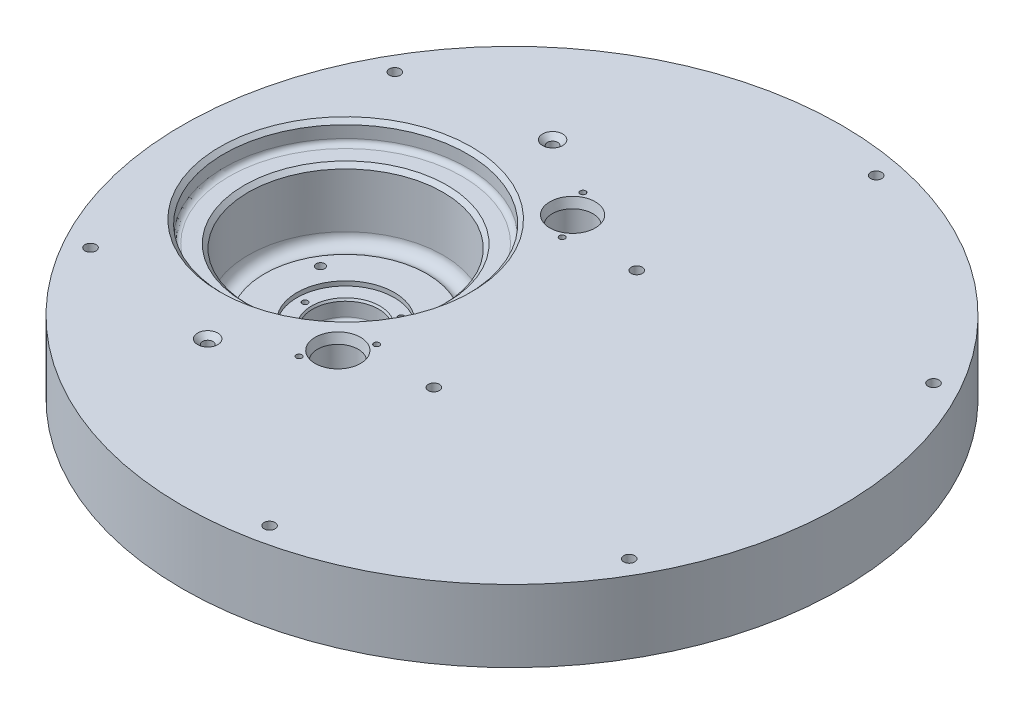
SolidWorks part; units mm, degrees
ref_plane "Front Plane" through (0, 0, 0) normal (0, 0, 1) x (1, 0, 0)
ref_plane "Top Plane" through (0, 0, 0) normal (0, 1, 0) x (1, 0, 0)
ref_plane "Right Plane" through (0, 0, 0) normal (1, 0, 0) x (0, 0, -1)
sketch "Sketch3" plane through (0, 0, 0) normal (0, 0, 1) x (1, 0, 0)
  line L0 (0, 0) -> (0, 118.5233) construction
  line L1 (177.8, 0) -> (38.1, 0)
  line L2 (30.48, -6.604) -> (30.48, -24.892)
  line L3 (25.4, -27.432) -> (15.24, -27.432)
  line L4 (8.636, -30.48) -> (8.636, -7.874) construction
  line L5 (8.636, -7.874) -> (0, -7.874) construction
  line L6 (0, -7.874) -> (0, -9.906) construction
  line L7 (0, -9.906) -> (7.366, -9.906) construction
  line L8 (7.366, -9.906) -> (7.366, -37.592) construction
  line L9 (7.366, -37.592) -> (36.195, -37.592)
  line L10 (36.195, -37.592) -> (36.195, -22.5425)
  line L11 (36.195, -22.5425) -> (177.8, -22.5425)
  line L12 (177.8, -22.5425) -> (177.8, 0)
  line L13 (30.48, -6.604) -> (38.1, -6.604)
  line L14 (38.1, -6.604) -> (38.1, 0)
  line L15 (10.3378, -28.829) -> (15.24, -28.829)
  line L16 (7.366, -34.544) -> (7.366, -37.592)
  line L17 (7.366, -34.544) -> (10.3378, -34.544)
  line L18 (10.3378, -34.544) -> (10.3378, -28.829)
  line L19 (15.24, -28.829) -> (15.24, -27.432)
  line L20 (10.3378, -28.829) -> (10.3378, -27.432) construction
  line L21 (10.3378, -27.432) -> (15.24, -27.432) construction
  line L22 (29.21, -27.432) -> (30.48, -21.0216) construction
  arc A0 (25.4, -27.432) -> (30.48, -24.892) centre (27.305, -24.892) ccw
  dimension "D11" = 7.112
  dimension "D3" = 3.175
  dimension "D1" = 60.96
  dimension "D2" = 27.432
  dimension ".78" = 22.5425
  dimension "D4" = 355.6
  dimension "D5" = 76.2
  dimension "D6" = 20.828
  dimension "D7" = 8.636
  dimension "D8" = 7.366
  dimension "D9" = 19.558
  dimension "D10" = 2.032
  dimension "D12" = 20.6756
  dimension "D13" = 30.48
  dimension "D14" = 1.397
  dimension "D15" = 72.39
  dimension "D16" = 10.16
  dimension "D17" = 37.592
  dimension "D18" = 1.27
revolve "Revolve1" add sketch "Sketch3" angle 360 about L0
chamfer "Chamfer4" distance 0.381 angle 60 1 edges at (0, -28.829, -10.3378)
sketch "Sketch4" plane through (0, 0, 0) normal (0, 1, 0) x (1, 0, 0)
  line L0 (0, 0) -> (52.07, 0) construction
  line L1 (52.07, -103.1621) -> (52.07, 103.1621) construction
  line L2 (-51.0921, 0) -> (52.07, 0) construction
  line L3 (0.4889, 89.341) -> (0.4889, -89.341) construction
  circle A0 centre (52.07, 0) radius 103.1621
  circle A1 centre (-51.0921, 0) radius 103.1621 construction
  dimension "D1" = 206.3242
  dimension "D2" = 52.07
extrude "Cut-Extrude1" cut sketch "Sketch4" against normal through all flip side to cut
sketch "Sketch30" plane through (0, -6.604, 0) normal (0, 1, 0) x (1, 0, 0)
  line L0 (0, 44.0093) -> (0, 21.5836) construction
  line L1 (0, 21.5836) -> (0, 0) construction
  circle A0 centre (0, 0) radius 44.0093
  arc A1 (15.9166, 25.9941) -> (-15.9166, 25.9941) centre (0, 21.5836) ccw
  arc A3 (30.4698, 0.7871) -> (15.9166, 25.9941) centre (0, 0) ccw
  circle A4 centre (0, 0) radius 30.48 construction
  circle A5 centre (0, 0) radius 21.5836 construction
  arc A6 (14.5532, -26.7812) -> (30.4698, 0.7871) centre (18.692, -10.7918) ccw
  arc A7 (-30.4698, 0.7871) -> (-14.5532, -26.7812) centre (-18.692, -10.7918) ccw
  arc A8 (-14.5532, -26.7812) -> (14.5532, -26.7812) centre (0, 0) ccw
  arc A9 (-15.9166, 25.9941) -> (-30.4698, 0.7871) centre (0, 0) ccw
  circle A10 centre (0, 0) radius 38.1 construction
  point P19 (0, 0)
  dimension "D1" = 43.1673
  dimension "D2" = 3
sketch "Sketch23" plane through (0, -37.592, 0) normal (0, -1, 0) x (1, 0, 0)
  line L0 (0, 0) -> (-36.195, 0) construction
  line L1 (3.4925, 0) -> (0, 0) construction
  circle A0 centre (3.4925, 0) radius 39.6875
  circle A1 centre (0, 0) radius 36.195 construction
  circle A2 centre (0, 0) radius 31.75
  dimension "D1" = 79.375
  dimension "D2" = 63.5
extrude "Boss-Extrude2" add sketch "Sketch23" against normal up to surface (15.0495 mm away)
hole_wizard "#30 (0.1285) Diameter Hole1" positions "Sketch7" profile "Sketch6" hole size "#30" standard "ANSI Inch"
sketch "Sketch7" plane through (0, -22.5425, 0) normal (0, 1, 0) x (1, 0, 0)
  line L0 (10.795, 53.975) -> (0, 0) construction
  line L1 (0, 0) -> (10.795, -53.975) construction
  line L3 (10.795, 53.975) -> (10.795, -53.975) construction
  line L5 (0, 0) -> (10.795, 0) construction
  line L6 (10.795, 0) -> (52.07, 0) construction
  point P0 (10.795, -53.975)
  point P2 (10.795, 53.975)
  dimension "D1" = 107.95
  dimension "D2" = 41.275
sketch "Sketch6" plane through (10.795, -22.5425, 53.975) normal (1, 0, 0) x (0, 0, -1)
  line L0 (0, 0) -> (0, 22.5425)
  line L1 (0, 22.5425) -> (1.6319, 22.5425)
  line L2 (1.6319, 22.5425) -> (1.6319, 0)
  line L5 (1.6319, 0) -> (0, 0)
  line L11 (0, -6.35) -> (0, 107.95) construction
  dimension "Thru Hole Dia." = 3.2639
  dimension "Thru Hole Depth" = 22.5425
ref_plane "Plane1" through (0, 0, 53.975) normal (0, 0, 1) x (1, 0, 0)
sketch "Sketch219" plane through (0, 0, 53.975) normal (0, 0, 1) x (1, 0, 0)
  line L0 (10.795, -22.5425) -> (10.795, 27.4283)
  line L1 (14.2494, -10.6553) -> (12.3825, -9.5336)
  line L2 (14.9421, -20.6629) -> (14.2494, -19.9702)
  line L3 (14.9421, -20.6629) -> (15.3416, -22.5425)
  line L4 (15.3416, -22.5425) -> (10.795, -22.5425)
  line L5 (10.795, -22.5425) -> (10.795, 42.3633) construction
  line L6 (14.2494, -19.9702) -> (14.2494, -10.6553)
  line L10 (19.3294, -23.7831) -> (19.3294, -22.5425) construction
  line L11 (19.3294, -22.5425) -> (15.3416, -22.5425) construction
  line L12 (12.3825, -9.5336) -> (12.3825, 26.4744)
  line L13 (12.3825, 26.4744) -> (10.795, 27.4283)
  line L14 (10.795, 0) -> (10.795, -22.5425) construction
  line L15 (9.1631, -22.5425) -> (12.4269, -22.5425) construction
  dimension "D1" = 12
  dimension "D2" = 45
  dimension "D3" = 1.8796
  dimension "D5" = 8.5344
  dimension "D6" = 9.0932
  dimension "D7" = 59
  dimension "D8" = 11.8872
  dimension "D9" = 3.175
  dimension ".375" = 6.9088
revolve "Cut-Revolve2" cut sketch "Sketch219" angle 360 about L5
chamfer "Chamfer1" distance 1.524 angle 45 2 edges at (10.795, 0, 52.3431) (10.795, 0, -55.6069)
sketch "Sketch11" plane through (0, -22.5425, 0) normal (0, -1, 0) x (1, 0, 0)
  line L0 (52.07, 88.265) -> (52.07, -88.265) construction
  line L1 (52.07, 0) -> (140.335, 0) construction
  line L2 (77.47, -12.7) -> (139.4166, -12.7)
  line L3 (42.545, 87.7496) -> (42.545, 36.7423)
  line L4 (77.47, 12.7) -> (139.4166, 12.7)
  line L5 (67.945, 86.8257) -> (67.945, 22.225)
  line L6 (67.945, -22.225) -> (67.945, -86.8257)
  line L7 (67.945, 12.7) -> (67.945, -12.7) construction
  line L8 (42.545, -36.7423) -> (34.29, -36.7423) construction
  line L9 (34.29, -36.7423) -> (34.29, 36.7423) construction
  line L10 (42.545, -36.7423) -> (42.545, -87.7496)
  line L11 (42.545, 36.7423) -> (42.545, -36.7423) construction
  line L12 (34.29, 36.7423) -> (42.545, 36.7423) construction
  circle A0 centre (3.4925, 0) radius 39.6875 construction
  arc A1 (42.545, -87.7496) -> (67.945, -86.8257) centre (52.07, 0) ccw
  arc A2 (67.945, 86.8257) -> (42.545, 87.7496) centre (52.07, 0) ccw
  arc A3 (77.47, -12.7) -> (67.945, -22.225) centre (77.47, -22.225) ccw
  arc A4 (139.4166, -12.7) -> (139.4166, 12.7) centre (52.07, 0) ccw
  arc A5 (28.9871, -30.4158) -> (28.9871, 30.4158) centre (3.4925, 0) ccw
  arc A6 (28.9871, 30.4158) -> (42.545, 36.7423) centre (34.29, 36.7423) ccw
  arc A7 (42.545, -36.7423) -> (28.9871, -30.4158) centre (34.29, -36.7423) ccw
  arc A8 (77.47, 12.7) -> (67.945, 22.225) centre (77.47, 22.225) cw
  circle A9 centre (52.07, 0) radius 103.1621 construction
  circle A10 centre (52.07, 0) radius 88.265 construction
  dimension "D3" = 8.255
  dimension "D4" = 9.525
  dimension "D1" = 25.4
  dimension "D2" = 25.4
  dimension "D5" = 9.525
extrude "Boss-Extrude1" add sketch "Sketch11" along normal up to surface (15.0495 mm away)
sketch "Sketch29" plane through (0, -22.5425, 0) normal (0, -1, 0) x (1, 0, 0)
  line L0 (42.545, 51.8628) -> (42.545, 36.7423)
  line L1 (0, 0) -> (86.9994, 0) construction
  line L2 (42.545, -51.8628) -> (42.545, -36.7423)
  arc A0 (28.9871, 30.4158) -> (42.545, 36.7423) centre (34.29, 36.7423) ccw
  arc A1 (35.4012, 45.5626) -> (42.545, 51.8628) centre (36.195, 51.8628) ccw
  arc A2 (18.005, 36.9389) -> (26.1449, 40.3046) centre (20.327, 42.8491) ccw
  arc A3 (28.9871, 30.4158) -> (18.005, 36.9389) centre (3.4925, 0) ccw
  arc A4 (28.9871, 30.4158) -> (28.9871, -30.4158) centre (3.4925, 0) ccw construction
  arc A5 (28.9871, 30.4158) -> (42.545, 36.7423) centre (34.29, 36.7423) ccw construction
  arc A6 (35.4012, 45.5626) -> (26.1449, 40.3046) centre (34.29, 36.7423) ccw
  arc A7 (35.4012, -45.5626) -> (42.545, -51.8628) centre (36.195, -51.8628) cw
  arc A8 (28.9871, -30.4158) -> (42.545, -36.7423) centre (34.29, -36.7423) cw
  arc A9 (28.9871, -30.4158) -> (18.005, -36.9389) centre (3.4925, 0) cw
  arc A10 (18.005, -36.9389) -> (26.1449, -40.3046) centre (20.327, -42.8491) cw
  arc A11 (35.4012, -45.5626) -> (26.1449, -40.3046) centre (34.29, -36.7423) cw
  dimension "D1" = 8.89
  dimension "D2" = 6.35
chamfer "Chamfer5" distance 14.986 angle 30 3 edges at (55.2784, -37.592, 88.2067) (140.335, -37.592, 0) (55.2784, -37.592, -88.2067)
fillet "Fillet7" radius 4.7752 11 edges at (67.945, -22.5425, 54.5253) (108.4433, -22.5425, -12.7) (42.545, -22.5425, 62.2459) (37.7807, -22.5425, 29.2617) (42.545, -22.5425, -62.2459) (37.7807, -22.5425, -29.2617) (108.4433, -22.5425, 12.7) (67.945, -22.5425, -54.5253) (-36.195, -22.5425, 0) (70.7348, -22.5425, 15.4898) (70.7348, -22.5425, -15.4898)
hole_wizard "Pene-Ports" positions "Sketch13" profile "Sketch12" counterbore size "#10" standard "ANSI Inch"
sketch "Sketch13" plane through (0, 0, 0) normal (0, 1, 0) x (1, 0, 0)
  line L0 (34.29, 36.7423) -> (34.29, -36.7423) construction
  line L1 (34.29, 0) -> (0, 0) construction
  arc A0 (28.9871, 30.4158) -> (42.545, 36.7423) centre (34.29, 36.7423) ccw construction
  point P0 (34.29, 36.7423)
  point P2 (34.29, -36.7423)
sketch "Sketch12" plane through (34.29, 0, -36.7423) normal (1, 0, 0) x (0, 0, 1)
  line L0 (0, 0) -> (0, 53.7142)
  line L1 (0, 53.7142) -> (4.85, 50.8)
  line L2 (4.85, 50.8) -> (4.85, 17.272)
  line L3 (4.85, 17.272) -> (6.35, 17.272)
  line L5 (6.35, 17.272) -> (6.35, 2.8438)
  line L6 (6.35, 2.8438) -> (7.112, 0)
  line L7 (7.112, 0) -> (0, 0)
  line L10 (0, 53.7142) -> (-4.85, 50.8) construction
  line L11 (0, -6.35) -> (0, 107.95) construction
  dimension "Hole Dia." = 9.7
  dimension "Hole Depth" = 50.8
  dimension "C'Bore Dia." = 12.7
  dimension "Drill Angle" = 118
fillet "Fillet5" radius 0.762 3 edges at (0, -34.544, -10.3378) (34.29, -17.272, -30.3923) (34.29, -17.272, 43.0923)
fillet "Fillet8" radius 1.5875 1 edges at (0, -6.604, -38.1)
chamfer "Chamfer8" distance 1.27 angle 45 2 edges at (0, -6.604, -30.48) (0, 0, -38.1)
chamfer "Chamfer6" distance 0.254 angle 30 2 edges at (0, -37.592, -7.366) (0, -34.544, -7.366)
sketch "Sketch14" plane through (0, 0, 0) normal (0, 0, 1) x (1, 0, 0)
  line L0 (52.07, 0) -> (52.07, 60.9046) construction
  line L1 (-48.7045, -13.9446) -> (-38.5763, -13.9446)
  line L2 (52.07, 0) -> (155.2321, 0) construction
  line L3 (52.07, 0) -> (-51.0921, 0) construction
  line L4 (-36.195, -16.3259) -> (-36.195, -23.0201)
  line L5 (-58.5313, -32.8598) -> (-36.195, -37.592)
  line L6 (-36.195, -37.592) -> (28.9871, -37.592) construction
  line L7 (-51.0921, 0) -> (-58.5313, 0)
  line L8 (-58.5313, 0) -> (-58.5313, -15.24)
  line L9 (-51.0921, -11.9126) -> (-48.3462, -11.9126) construction
  line L10 (-48.514, -2.7686) -> (-51.0921, -6.8326) construction
  line L11 (-51.0921, -9.8806) -> (-51.0921, -13.9446)
  line L12 (-51.0921, -12.6746) -> (-49.3248, -14.4419) construction
  line L13 (-48.7045, -13.9446) -> (-48.1456, -10.7749) construction
  line L14 (-48.896, -9.8806) -> (-51.0921, -9.8806) construction
  line L15 (-51.0921, 0) -> (-51.0921, -22.5425) construction
  line L16 (-51.0921, -9.8806) -> (-51.0921, -6.8326)
  line L17 (-51.0921, -6.8326) -> (-48.514, -6.8326) construction
  line L18 (-48.514, -6.8326) -> (-48.514, -2.7686) construction
  line L19 (-48.514, -2.7686) -> (-51.0921, -2.7686) construction
  line L20 (-51.0921, -2.7686) -> (-51.0921, 0)
  line L21 (-51.0921, 0) -> (-51.0921, -22.5425) construction
  line L22 (-58.5313, -15.24) -> (-58.5313, -32.8598)
  line L23 (-51.0921, -13.9446) -> (-48.7045, -13.9446)
  line L25 (-36.195, -23.0201) -> (-36.195, -37.592)
  line L26 (-51.0921, -6.8326) -> (-51.0921, -2.7686)
  arc A0 (-48.1456, -10.7749) -> (-48.896, -9.8806) centre (-48.896, -10.6426) ccw construction
  arc A1 (-38.5763, -13.9446) -> (-36.195, -16.3259) centre (-38.5763, -16.3259) cw
  circle A2 centre (-49.8031, -4.8006) radius 1.7653 construction
  circle A3 centre (-49.7192, -11.9126) radius 1.7653 construction
  dimension "D6" = 0.762
  dimension "D9" = 2.3813
  dimension "D10" = 3.5306
  dimension "D1" = 100.584
  dimension "D2" = 4.064
  dimension "D3" = 4.064
  dimension "D4" = 201.549
  dimension "D5" = 10
  dimension "D7" = 45
  dimension "D8" = 13.9446
  dimension "D11" = 1.27
  dimension "D12" = 7.112
  dimension "D13" = 200.8324
revolve "Cut-Revolve1" [suppressed] cut sketch "Sketch14" angle 360 about L0
hole_wizard "#2-56 Tapped Hole1" positions "Sketch16" profile "Sketch15" tap size "#2-56" standard "ANSI Inch"
sketch "Sketch16" plane through (0, -28.829, 0) normal (0, 1, 0) x (1, 0, 0)
  line L3 (0, 0) -> (-12.7, 0) construction
  point P4 (-12.7, 0)
  dimension "D1" = 12.7
sketch "Sketch15" plane through (-12.7, -28.829, 0) normal (1, 0, 0) x (0, 0, 1)
  line L0 (0, 0) -> (0, 3.0742)
  line L1 (0, 3.0742) -> (0.889, 2.54)
  line L2 (0.889, 2.54) -> (0.889, 0)
  line L5 (0.889, 0) -> (0, 0)
  line L10 (0, 3.0742) -> (-0.889, 2.54) construction
  line L11 (0, -6.35) -> (0, 107.95) construction
  dimension "Tap Drill Dia." = 1.778
  dimension "Tap Drill Depth" = 2.54
  dimension "Drill Angle" = 118
sketch "Sketch17" plane through (0, -22.5425, 0) normal (0, -1, 0) x (1, 0, 0)
  circle A0 centre (10.795, 53.975) radius 3.048
  circle A1 centre (10.795, 53.975) radius 4.5466 construction
  dimension "D1" = 6.096
extrude "Cut-Extrude5" cut sketch "Sketch17" against normal blind 15.875
chamfer "Chamfer9" distance 0.508 angle 30 1 edges at (10.795, -10.4111, 50.927)
pattern_circular "CirPattern1" count 3 over 360 about axis through (0, 0, 0) along (0, 1, 0) of "#2-56 Tapped Hole1"
hole_wizard "#10-32 Tapped Hole1" positions "Sketch19" profile "Sketch20" tap size "#10-32" standard "ANSI Inch"
sketch "Sketch19" [suppressed] plane through (0, -13.9446, 0) normal (0, -1, 0) x (-1, 0, 0)
  line L0 (-16.2269, 86.5329) -> (-52.07, 0) construction
  line L1 (-52.07, 0) -> (-52.07, 118.0269) construction
  circle A0 centre (-52.07, 0) radius 100.7745 construction
  circle A1 centre (-52.07, 0) radius 93.6625 construction
  point P0 (-16.2269, 86.5329)
  dimension "D1" = 187.325
  dimension "D2" = 22.5
sketch "Sketch20" plane through (16.2269, -13.9446, -86.5329) normal (1, 0, 0) x (0, 0, -1)
  line L0 (0, 0) -> (0, 8.8333)
  line L1 (0, 8.8333) -> (2.0193, 7.62)
  line L2 (2.0193, 7.62) -> (2.0193, 6.35)
  line L3 (2.0193, 6.35) -> (2.413, 6.35)
  line L4 (2.413, 6.35) -> (2.413, 0)
  line L5 (2.413, 0) -> (0, 0)
  line L10 (0, 8.8333) -> (-2.0193, 7.62) construction
  line L11 (0, -6.35) -> (0, 107.95) construction
  dimension "Tap Drill Dia." = 4.0386
  dimension "Tap Drill Depth" = 7.62
  dimension "Thread Major Dia." = 4.826
  dimension "Thread Depth" = 6.35
  dimension "Drill Angle" = 118
pattern_circular "CirPattern2" [suppressed] count 8 over 360
hole_wizard "#8-32 Tapped Hole2" positions "Sketch22" profile "Sketch21" tap size "#8-32" standard "ANSI Inch"
sketch "Sketch22" plane through (0, 0, 0) normal (0, 1, 0) x (1, 0, 0)
  line L0 (52.07, 0) -> (52.07, 118.3341) construction
  circle A13 centre (71.12, -94.9452) radius 2.5337 construction
  circle A14 centre (-32.247, -47.625) radius 2.5336 construction
  circle A15 centre (-32.247, 47.625) radius 2.5336 construction
  circle A16 centre (71.12, 94.9452) radius 2.5337 construction
  circle A17 centre (59.3684, 31.75) radius 2.5336 construction
  circle A18 centre (59.3684, -31.75) radius 2.5336 construction
  point P0 (71.12, 94.9452)
  point P2 (-32.247, 47.625)
  point P4 (-32.247, -47.625)
  point P6 (71.12, -94.9452)
  point P8 (59.3684, 31.75)
  point P10 (59.3684, -31.75)
  point P53 (136.387, -47.625)
  point P54 (136.387, 47.625)
sketch "Sketch21" plane through (71.12, 0, -94.9452) normal (1, 0, 0) x (0, 0, 1)
  line L0 (0, 0) -> (0, 9.9278)
  line L1 (0, 9.9278) -> (1.7272, 8.89)
  line L2 (1.7272, 8.89) -> (1.7272, 0)
  line L5 (1.7272, 0) -> (0, 0)
  line L10 (0, 9.9278) -> (-1.7272, 8.89) construction
  line L11 (0, -6.35) -> (0, 107.95) construction
  dimension "Tap Drill Dia." = 3.4544
  dimension "Tap Drill Depth" = 8.89
  dimension "Drill Angle" = 118
hole_wizard "#6-32 Tapped Hole1" positions "Sketch25" profile "Sketch26" tap size "#6-32" standard "ANSI Inch"
sketch "Sketch25" plane through (0, -27.432, 0) normal (0, 1, 0) x (1, 0, 0)
  circle A3 centre (-18.6975, 10.795) radius 1.8288 construction
  circle A4 centre (0, -21.59) radius 1.8288 construction
  circle A5 centre (18.6975, 10.795) radius 1.8288 construction
  point P0 (-18.6975, 10.795)
  point P2 (18.6975, 10.795)
  point P4 (0, -21.59)
sketch "Sketch26" plane through (-18.6975, -27.432, -10.795) normal (1, 0, 0) x (0, 0, 1)
  line L0 (0, 0) -> (0, 5.5752)
  line L1 (0, 5.5752) -> (1.3525, 4.7625)
  line L2 (1.3525, 4.7625) -> (1.3525, 0)
  line L5 (1.3525, 0) -> (0, 0)
  line L10 (0, 5.5752) -> (-1.3526, 4.7625) construction
  line L11 (0, -6.35) -> (0, 107.95) construction
  dimension "Tap Drill Dia." = 2.7051
  dimension "Tap Drill Depth" = 4.7625
  dimension "Drill Angle" = 118
hole_wizard "#2-56 Tapped Hole2" positions "Sketch28" profile "Sketch27" tap size "#2-56" standard "ANSI Inch"
sketch "Sketch28" plane through (0, 0, 0) normal (0, 1, 0) x (1, 0, 0)
  circle A1 centre (38.735, -29.0433) radius 2.032 construction
  circle A2 centre (29.845, -44.4413) radius 2.032 construction
  circle A3 centre (29.845, 44.4413) radius 2.032 construction
  circle A4 centre (38.735, 29.0433) radius 2.032 construction
  point P0 (29.845, 44.4413)
  point P4 (38.735, 29.0433)
  point P8 (38.735, -29.0433)
  point P10 (29.845, -44.4413)
sketch "Sketch27" plane through (29.845, 0, -44.4413) normal (1, 0, 0) x (0, 0, 1)
  line L0 (0, 0) -> (0, 7.1763)
  line L1 (0, 7.1763) -> (0.889, 6.6421)
  line L2 (0.889, 6.6421) -> (0.889, 0)
  line L5 (0.889, 0) -> (0, 0)
  line L10 (0, 7.1763) -> (-0.889, 6.6421) construction
  line L11 (0, -6.35) -> (0, 107.95) construction
  dimension "Tap Drill Dia." = 1.778
  dimension "Tap Drill Depth" = 6.6421
  dimension "Drill Angle" = 118
chamfer "Chamfer7" distance 1.27 angle 45 11 edges at (42.545, -37.592, 57.8916) (42.545, -37.592, -57.8916) (37.7807, -37.592, 29.2617) (37.7807, -37.592, -29.2617) (-36.195, -37.592, 0) (67.945, -37.592, 50.1195) (70.7348, -37.592, 15.4898) (104.0667, -37.592, 12.7) (104.0667, -37.592, -12.7) (70.7348, -37.592, -15.4898) (67.945, -37.592, -50.1195)
sketch "Sketch9" plane through (0, 0, 0) normal (0, 1, 0) x (1, 0, 0)
  line L0 (0, 0) -> (-113.3456, 0) construction
  line L1 (-64.7098, 0) -> (173.9981, 0)
  arc A0 (-64.7098, 0) -> (173.9981, 0) centre (54.6442, 0) ccw
extrude "FEA-Cut-Extrude3" [suppressed] cut sketch "Sketch9" against normal through all
hole_wizard "M4x0.7 Tapped Hole1" positions "Sketch213" profile "Sketch212" tap size "M4x0.7" standard "ANSI Metric"
sketch "Sketch213" plane through (0, -22.5425, 0) normal (0, -1, 0) x (-1, 0, 0)
  line L0 (12.7, -48.26) -> (-52.07, 0) construction
  line L1 (-52.07, 0) -> (-52.07, -48.26) construction
  line L3 (12.7, -48.26) -> (-52.07, -48.26) construction
  point P0 (12.7, -48.26)
  dimension "D1" = 64.77
  dimension "D2" = 48.26
sketch "Sketch212" plane through (-12.7, -22.5425, 48.26) normal (1, 0, 0) x (0, 0, -1)
  line L0 (0, 0) -> (0, 22.5425)
  line L1 (0, 22.5425) -> (1.65, 22.5425)
  line L3 (1.65, 22.5425) -> (1.65, 6)
  line L4 (1.65, 6) -> (2, 6)
  line L5 (2, 6) -> (2, 0)
  line L7 (2, 0) -> (0, 0)
  line L11 (0, -6.35) -> (0, 107.95) construction
  dimension "Thru Tap Drill Dia." = 3.3
  dimension "Thru Tap Drill Depth" = 22.5425
  dimension "Thread Major Dia." = 4
  dimension "Thread Depth" = 6
sketch "Sketch214" [suppressed] plane through (0, -22.5425, 0) normal (0, -1, 0) x (1, 0, 0)
  line L1 (-9.35, 51.4397) -> (-13.7787, 52.7511) construction
  line L2 (-13.7787, 52.7511) -> (-17.1287, 49.5714) construction
  line L3 (-17.1287, 49.5714) -> (-16.05, 45.0803) construction
  line L4 (-16.05, 45.0803) -> (-11.6213, 43.7689) construction
  line L5 (-11.6213, 43.7689) -> (-8.2713, 46.9486) construction
  line L6 (-8.2713, 46.9486) -> (-9.35, 51.4397) construction
  circle A0 centre (-12.7, 48.26) radius 4.7625
  circle A1 centre (-12.7, 48.26) radius 4 construction
  dimension "D1" = 8
  dimension "D2" = 9.525
extrude "Cut-Extrude6" [suppressed] cut sketch "Sketch214" against normal blind 0.127
hole_wizard "#4-40 Tapped Hole1" positions "Sketch216" profile "Sketch215" tap size "#4-40" standard "ANSI Inch"
sketch "Sketch216" plane through (0, -37.592, 0) normal (0, -1, 0) x (-1, 0, 0)
  line L0 (0, 0) -> (-31.75, 0) construction
  circle A0 centre (0, 0) radius 31.75 construction
  point P0 (-31.75, 0)
  point P16 (0, 31.75)
  point P17 (31.75, 0)
  point P18 (0, -31.75)
  dimension "D2" = 63.5
  dimension "D1" = 4
sketch "Sketch215" plane through (31.75, -37.592, 0) normal (1, 0, 0) x (0, 0, -1)
  line L0 (0, 0) -> (0, 5.3782)
  line L1 (0, 5.3782) -> (1.1303, 4.699)
  line L2 (1.1303, 4.699) -> (1.1303, 0)
  line L5 (1.1303, 0) -> (0, 0)
  line L10 (0, 5.3782) -> (-1.1303, 4.699) construction
  line L11 (0, -6.35) -> (0, 107.95) construction
  dimension "Tap Drill Dia." = 2.2606
  dimension "Tap Drill Depth" = 4.699
  dimension "Drill Angle" = 118
hole_wizard "Ø4.0 (4) Diameter Hole1" positions "Sketch218" profile "Sketch217" hole size "Ø4.0" standard "ANSI Metric"
sketch "Sketch218" [suppressed] plane through (0, 0, 0) normal (0, 1, 0) x (1, 0, 0)
  point P0 (-12.7, -48.26)
sketch "Sketch217" plane through (-12.7, 0, 48.26) normal (1, 0, 0) x (0, 0, 1)
  line L0 (0, 0) -> (0, 17.7117)
  line L1 (0, 17.7117) -> (2, 16.51)
  line L2 (2, 16.51) -> (2, 0)
  line L5 (2, 0) -> (0, 0)
  line L10 (0, 17.7117) -> (-2, 16.51) construction
  line L11 (0, -6.35) -> (0, 107.95) construction
  dimension "Hole Dia." = 4
  dimension "Hole Depth" = 16.51
  dimension "Drill Angle" = 118
mirror "Mirror1" about plane through (0, 0, 0) normal (0, 0, 1) of "Chamfer9", "Cut-Revolve2", "Cut-Extrude5"
hole_wizard "#6-32 Tapped Hole2" positions "Sketch223" profile "Sketch222" tap size "#6-32" standard "ANSI Inch"
sketch "Sketch223" plane through (0, -37.592, 0) normal (0, -1, 0) x (-1, 0, 0)
  line L1 (-55.245, -34.925) -> (-55.245, 0) construction
  line L11 (-52.8272, 0) -> (-61.6214, 0) construction
  line L12 (-43.815, -79.1837) -> (-43.815, -36.7423) construction
  line L13 (-66.675, -22.225) -> (-66.675, -78.2617) construction
  line L14 (-55.245, -34.925) -> (-55.245, -73.025) construction
  line L16 (-55.245, -53.975) -> (-10.795, -53.975) construction
  circle A5 centre (-55.245, -53.975) radius 11.43 construction
  circle A7 centre (-10.795, -53.975) radius 4.5466 construction
  point P77 (-55.245, -73.025)
  point P80 (-55.245, -34.925)
  point P82 (-55.245, 34.925)
  point P83 (-55.245, 73.025)
  point P86 (-55.245, -53.975)
  point P97 (-55.245, 53.975)
  dimension "D1" = 38.1
sketch "Sketch222" plane through (55.245, -37.592, -53.975) normal (1, 0, 0) x (0, 0, -1)
  line L0 (0, 0) -> (0, 11.7855)
  line L1 (0, 11.7855) -> (1.3525, 10.9728)
  line L2 (1.3525, 10.9728) -> (1.3525, 0)
  line L5 (1.3525, 0) -> (0, 0)
  line L10 (0, 11.7855) -> (-1.3526, 10.9728) construction
  line L11 (0, -6.35) -> (0, 107.95) construction
  dimension "Tap Drill Dia." = 2.7051
  dimension "Tap Drill Depth" = 10.9728
  dimension "Drill Angle" = 118
hole_wizard "#4-40 Tapped Hole2" positions "Sketch221" profile "Sketch220" tap size "#4-40" standard "ANSI Inch"
sketch "Sketch221" plane through (0, -37.592, 0) normal (0, -1, 0) x (-1, 0, 0)
  line L0 (-55.245, 0) -> (-55.245, -19.05) construction
  line L1 (-55.245, -19.05) -> (-55.245, -38.1) construction
  line L2 (-55.245, -38.1) -> (-55.245, -57.15) construction
  line L4 (-55.245, 0) -> (-55.245, 19.05) construction
  line L5 (-55.245, 19.05) -> (-55.245, 38.1) construction
  line L6 (-55.245, 38.1) -> (-55.245, 57.15) construction
  line L8 (-55.245, 0) -> (-74.295, 0) construction
  line L9 (-74.295, 0) -> (-93.345, 0) construction
  line L10 (-93.345, 0) -> (-112.395, 0) construction
  line L11 (-55.245, -57.15) -> (-55.245, -73.025) construction
  line L13 (-112.395, 0) -> (-131.6828, 0) construction
  arc A1 (-130.8581, 11.43) -> (-130.8581, -11.43) centre (-52.07, 0) ccw construction
  point P4 (-55.245, -19.05)
  point P6 (-55.245, 19.05)
  point P12 (-55.245, 0)
  point P14 (-74.295, 0)
  point P16 (-93.345, 0)
  point P18 (-112.395, 0)
  dimension "D1" = 19.05
sketch "Sketch220" plane through (55.245, -37.592, 19.05) normal (1, 0, 0) x (0, 0, -1)
  line L0 (0, 0) -> (0, 9.5438)
  line L1 (0, 9.5438) -> (1.1303, 8.8646)
  line L2 (1.1303, 8.8646) -> (1.1303, 0)
  line L5 (1.1303, 0) -> (0, 0)
  line L10 (0, 9.5438) -> (-1.1303, 8.8646) construction
  line L11 (0, -6.35) -> (0, 107.95) construction
  dimension "Tap Drill Dia." = 2.2606
  dimension "Tap Drill Depth" = 8.8646
  dimension "Drill Angle" = 118
